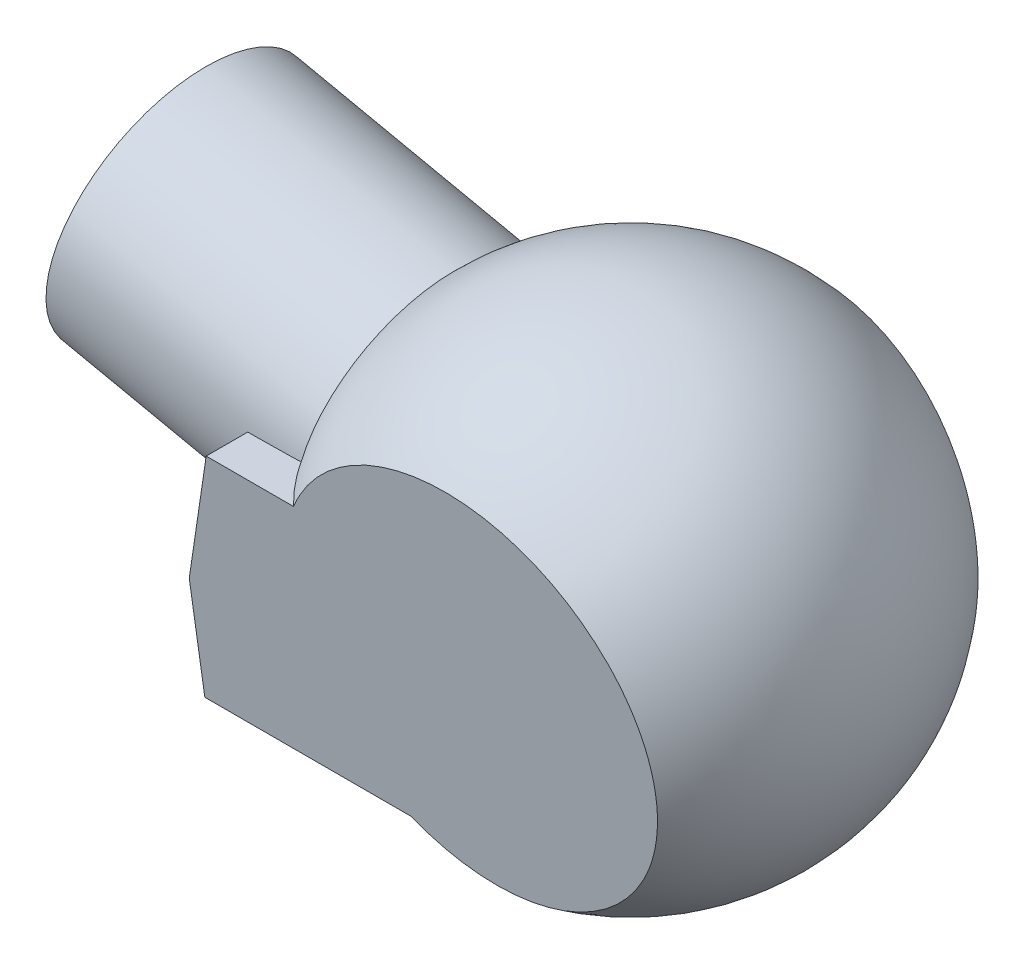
SolidWorks part; units mm, degrees
ref_plane "Front Plane" through (0, 0, 0) normal (0, 0, 1) x (1, 0, 0)
ref_plane "Top Plane" through (0, 0, 0) normal (0, 1, 0) x (1, 0, 0)
ref_plane "Right Plane" through (0, 0, 0) normal (1, 0, 0) x (0, 0, -1)
sketch "Sketch1" plane through (0, 0, 0) normal (0, 0, 1) x (1, 0, 0)
  line L0 (-107.95, 0) -> (107.95, 0) construction
  line L1 (-107.95, 0) -> (107.95, 0)
  arc A0 (107.95, 0) -> (-107.95, 0) centre (0, 0) ccw
  dimension "D1" = 215.9
revolve "Revolve1" add sketch "Sketch1" angle 360 about L0
sketch "Sketch2" plane through (0, 0, 0) normal (1, 0, 0) x (0, 0, -1)
  line L0 (-75.3843, 25.4) -> (75.3843, 25.4)
  line L1 (75.3843, 25.4) -> (60.325, -81.7524)
  line L2 (-75.3843, 25.4) -> (-60.325, -81.7524)
  line L3 (0, 0) -> (0, 25.4) construction
  arc A0 (-60.325, -81.7524) -> (60.325, -81.7524) centre (0, 0) ccw
  dimension "D1" = 101.6
  dimension "D2" = 120.65
  dimension "D3" = 25.4
  dimension "D4" = 16
extrude "Extrude1" add sketch "Sketch2" against normal blind 127
sketch "Sketch3" plane through (0, 0, 0) normal (0, 0, 1) x (1, 0, 0)
  line L0 (12.7, -95.25) -> (-35.56, -131.445)
  line L1 (-50.8, -123.825) -> (-50.8, -95.25)
  line L2 (-50.8, -95.25) -> (12.7, -95.25)
  line L4 (-127, 25.4) -> (-127, -81.7524) construction
  line L5 (-127, -101.6) -> (-36.478, -101.6) construction
  arc A0 (-35.56, -131.445) -> (-50.8, -123.825) centre (-41.275, -123.825) cw
  dimension "D1" = 9.525
  dimension "D3" = 38.1
  dimension "D2" = 63.5
  dimension "D4" = 76.2
  dimension "D5" = 6.35
extrude "Extrude2" add sketch "Sketch3" against normal mid plane 25.4
chamfer "Chamfer1" distance 58.42 angle 15 1 edges at (-127, 25.4, 0)
sketch "Sketch5" plane through (0, 0, 0) normal (0, 0, 1) x (1, 0, 0)
  line L0 (0, 0) -> (-198.7596, 42.2477)
  line L1 (-198.7596, 42.2477) -> (-186.8774, 98.1488)
  line L2 (-186.8774, 98.1488) -> (11.8822, 55.9011)
  line L3 (11.8822, 55.9011) -> (0, 0)
  line L4 (0, 0) -> (-136.0931, 0) construction
  dimension "D1" = 203.2
  dimension "D2" = 57.15
  dimension "D3" = 12
revolve "Revolve3" add sketch "Sketch5" angle 360 about L0
sketch "Sketch6" plane through (-127, 0, 0) normal (-1, 0, 0) x (0, 0, 1)
  line L0 (59.1207, -90.3213) -> (81.7264, 70.5266)
  line L1 (-59.1207, -90.3213) -> (-81.7264, 70.5266)
  line L2 (60.325, -81.7524) -> (75.3843, 25.4) construction
  line L3 (-67.1739, -33.02) -> (-75.3843, 25.4) construction
  line L4 (67.1739, -33.02) -> (60.325, -81.7524) construction
  arc A0 (-81.7264, 70.5266) -> (-59.1207, -90.3213) centre (0, 0) ccw
  arc A1 (59.1207, -90.3213) -> (81.7264, 70.5266) centre (0, 0) ccw
  dimension "D1" = 215.9
extrude "Cut-Extrude1" cut sketch "Sketch6" against normal through all
ref_plane "Plane1" through (107.95, 0, 0) normal (1, 0, 0) x (0, 0, -1)
fillet "Fillet2" [suppressed] radius 25.4
fillet "Fillet3" [suppressed] radius 25.4
fillet "Fillet4" [suppressed] radius 50.8
fillet "Fillet6" [suppressed] radius 19.05
fillet "Fillet7" [suppressed] radius 12.7
fillet "Fillet8" [suppressed] radius 6.35
